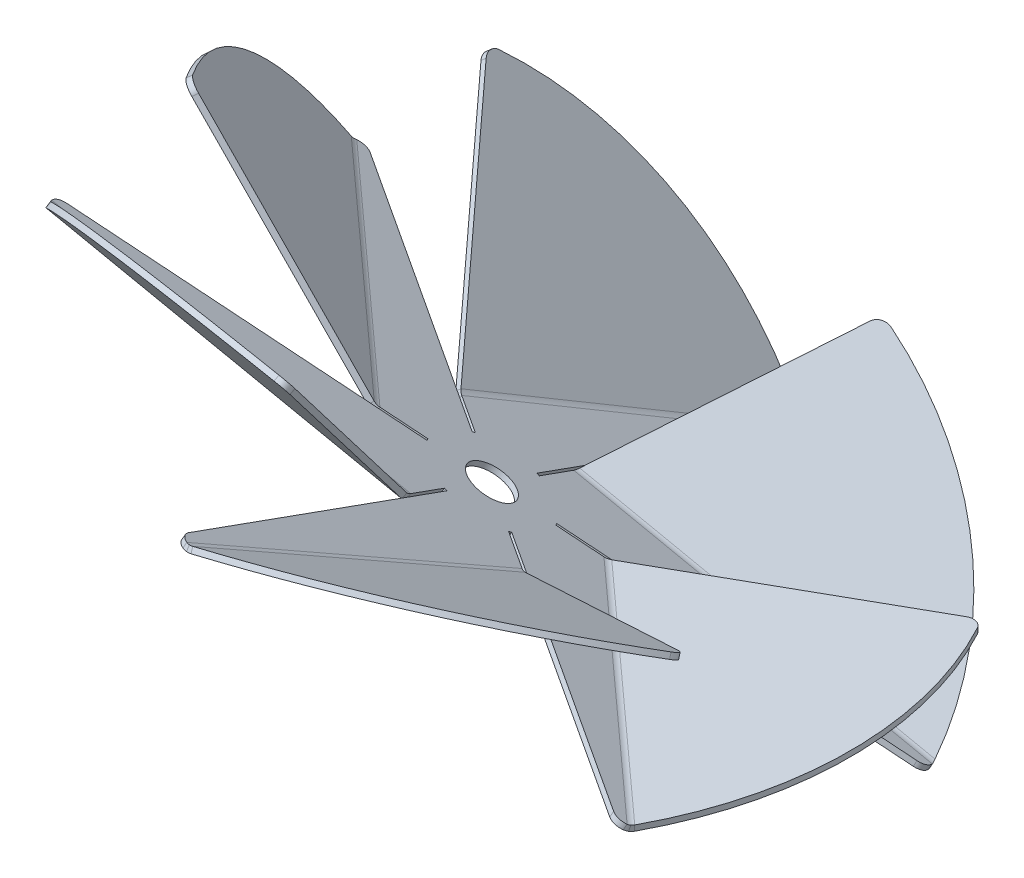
SolidWorks part; units mm, degrees
ref_plane "Front" through (0, 0, 0) normal (0, 0, 1) x (1, 0, 0)
ref_plane "Top" through (0, 0, 0) normal (0, 1, 0) x (1, 0, 0)
ref_plane "Right" through (0, 0, 0) normal (1, 0, 0) x (0, 0, -1)
sketch "Sketch1" plane through (0, 0, 0) normal (0, 1, 0) x (1, 0, 0)
  line L2 (-0.7937, -209.4282) -> (-0.7937, -31.7401)
  line L6 (0.7937, -209.4282) -> (0.7937, -31.7401)
  line L18 (27.0908, -16.5574) -> (180.9733, -105.4015)
  line L19 (27.8846, -15.1826) -> (181.767, -104.0267)
  line L20 (27.8846, 15.1826) -> (181.767, 104.0267)
  line L21 (27.0908, 16.5574) -> (180.9733, 105.4015)
  line L22 (0.7937, 31.7401) -> (0.7937, 209.4282)
  line L23 (-0.7937, 31.7401) -> (-0.7937, 209.4282)
  line L24 (-27.8846, 15.1826) -> (-181.767, 104.0267)
  line L25 (-27.0908, 16.5574) -> (-180.9733, 105.4015)
  line L26 (-27.8846, -15.1826) -> (-181.767, -104.0267)
  line L27 (-27.0908, -16.5574) -> (-180.9733, -105.4015)
  arc A0 (183.1861, 114.2614) -> (7.3602, 215.7745) centre (0, 0) ccw
  circle A1 centre (0, 0) radius 12.7
  arc A2 (-27.8846, -15.1826) -> (-27.0908, -16.5574) centre (0, 0) ccw
  arc A3 (-0.7937, -31.7401) -> (0.7937, -31.7401) centre (0, 0) ccw
  arc A4 (27.0908, -16.5574) -> (27.8846, -15.1826) centre (0, 0) ccw
  arc A5 (27.8846, 15.1826) -> (27.0908, 16.5574) centre (0, 0) ccw
  arc A6 (0.7937, 31.7401) -> (-0.7937, 31.7401) centre (0, 0) ccw
  arc A7 (-7.3602, 215.7745) -> (-183.1861, 114.2614) centre (0, 0) ccw
  arc A8 (-190.5463, 101.5131) -> (-190.5463, -101.5131) centre (0, 0) ccw
  arc A9 (-183.1861, -114.2614) -> (-7.3602, -215.7745) centre (0, 0) ccw
  arc A10 (7.3602, -215.7745) -> (183.1861, -114.2614) centre (0, 0) ccw
  arc A11 (180.9733, -105.4015) -> (183.1861, -114.2614) centre (177.7983, -110.9008) cw
  arc A12 (181.767, -104.0267) -> (190.5463, -101.5131) centre (184.942, -98.5274) ccw
  arc A13 (-27.0908, 16.5574) -> (-27.8846, 15.1826) centre (0, 0) ccw
  arc A14 (0.7937, -209.4282) -> (7.3602, -215.7745) centre (7.1437, -209.4282) ccw
  arc A15 (-0.7937, -209.4282) -> (-7.3602, -215.7745) centre (-7.1437, -209.4282) cw
  arc A16 (-180.9733, -105.4015) -> (-183.1861, -114.2614) centre (-177.7983, -110.9008) ccw
  arc A17 (-181.767, -104.0267) -> (-190.5463, -101.5131) centre (-184.942, -98.5274) cw
  arc A18 (-181.767, 104.0267) -> (-190.5463, 101.5131) centre (-184.942, 98.5274) ccw
  arc A19 (-180.9733, 105.4015) -> (-183.1861, 114.2614) centre (-177.7983, 110.9008) cw
  arc A20 (0.7937, 209.4282) -> (7.3602, 215.7745) centre (7.1437, 209.4282) cw
  arc A21 (-0.7937, 209.4282) -> (-7.3602, 215.7745) centre (-7.1437, 209.4282) ccw
  arc A22 (180.9733, 105.4015) -> (183.1861, 114.2614) centre (177.7983, 110.9008) ccw
  arc A23 (181.767, 104.0267) -> (190.5463, 101.5131) centre (184.942, 98.5274) cw
  arc A25 (190.5463, -101.5131) -> (190.5463, 101.5131) centre (0, 0) ccw
  point P30 (-0.7937, 253.9988)
  point P33 (0.7937, 253.9988)
  point P35 (0.7937, -215.8985)
  point P36 (219.5725, 127.6868)
  point P39 (220.3663, 126.312)
  point P41 (-0.7937, -215.8985)
  point P42 (219.5725, -127.6868)
  point P45 (220.3663, -126.312)
  point P46 (-186.5767, -108.6367)
  point P48 (0.7937, -253.9988)
  point P50 (-187.3705, -107.2619)
  point P51 (-0.7937, -253.9988)
  point P54 (-187.3705, 107.2619)
  point P56 (-219.5725, -127.6868)
  point P58 (-186.5767, 108.6367)
  point P61 (0.7937, 215.8985)
  point P64 (-0.7937, 215.8985)
  point P67 (186.5767, 108.6367)
  dimension "D1" = 431.8
  dimension "D2" = 6.35
sheet metal parameters "Sheet-Metal4" thickness 3.175 parameters "D1"=3.175
base flange "Base-Flange1" sketch "Sketch1" thickness 3.175 reverse thickness direction yes parameters "D1"=3.175
sketch "Sketch23" plane through (0, 3.175, 0) normal (0, 1, 0) x (1, 0, 0)
  line L3 (183.1861, 114.2614) -> (0.7937, 57.1445)
  line L5 (0.7937, 209.4282) -> (0.7937, 31.7401) construction
sketched bend "Sketched Bend10" parameters "D1"=6.35
bend "SketchBend26" bend radius 6.35 bend angle 30 parameters "D5"=7
sketch "Sketch24" plane through (0, 3.175, 0) normal (0, 1, 0) x (1, 0, 0)
  line L1 (190.5463, -101.5131) -> (49.8855, 27.8848)
  line L2 (181.767, 104.0267) -> (27.8846, 15.1826) construction
sketched bend "Sketched Bend11" parameters "D1"=6.35
bend "SketchBend27" bend radius 6.35 bend angle 30 parameters "D5"=8
sketch "Sketch25" plane through (10.1122, 25.8702, -10.9924) normal (0.3385, 0.866, -0.368) x (0.9409, -0.3092, 0.138)
  line L1 (183.0139, -98.1923) -> (22.7474, -21.4608) construction
  line L2 (18.4149, -221.6057) -> (45.661, -32.4313)
sketched bend "Sketched Bend13" parameters "D1"=6.35
bend "SketchBend28" bend radius 6.35 bend angle 30 parameters "D5"=9
sketch "Sketch28" plane through (38.4929, 31.7212, -9.3822) normal (0.7584, 0.625, -0.1849) x (-0.1445, -0.1153, -0.9828)
  line L1 (-200.0961, 73.3965) -> (-26.6765, 34.6834) construction
  line L2 (-67.4774, 230.6732) -> (-51.1132, 40.1385)
  line L3 (-200.0961, 73.3965) -> (-26.6765, 34.6834) construction
sketched bend "Sketched Bend14" parameters "D1"=6.35
bend "SketchBend29" bend radius 6.35 bend angle 30 parameters "D5"=10
sketch "Sketch29" plane through (38.4929, 31.7212, -9.3822) normal (0.7584, 0.625, -0.1849) x (-0.1445, -0.1153, -0.9828)
  line L1 (144.7172, 190.8456) -> (-12.2182, 81.7559)
  line L2 (-57.7978, 227.0584) -> (-4.6145, 57.5161) construction
sketched bend "Sketched Bend15" parameters "D1"=6.35
bend "SketchBend30" bend radius 6.35 bend angle 30 parameters "D5"=11
sketch "Sketch33" plane through (38.4929, 31.7212, -9.3822) normal (0.7584, 0.625, -0.1849) x (0.6515, -0.7195, 0.2406)
  line L1 (-211.2858, 97.1359) -> (-54.7594, 13.0375) construction
  line L4 (-211.2858, 97.1359) -> (-54.7594, 13.0375) construction
  line L5 (-37.2345, 201.1184) -> (-77.1383, 25.0612)
  arc A0 (-34.3705, 206.622) -> (-41.128, 212.7646) centre (-40.7176, 206.4279) ccw construction
sketched bend "Sketched Bend18" parameters "D1"=6.35
bend "SketchBend31" bend radius 6.35 bend angle 30 parameters "D5"=12
sketch "Sketch37" plane through (28.7528, 72.3942, -32.2674) normal (0.341, 0.8586, -0.3827) x (0.94, -0.3167, 0.127)
  line L0 (8.6191, -10.3873) -> (183.3365, -10.3873) construction
ref_plane "Plane4" through (0.1265, 4.1865, 9.5054) normal (0.0122, 0.403, 0.9151) x (0.9999, -0.0047, -0.0112)
sketch "Sketch38" plane through (0.1265, 4.1865, 9.5054) normal (0.0122, 0.403, 0.9151) x (0.9999, -0.0047, -0.0112)
  line L0 (62.5397, 146.6345) -> (33.0037, 74.3388) construction
sketch "Sketch39" plane through (0.1265, 4.1865, 9.5054) normal (0.0122, 0.403, 0.9151) x (0.9999, -0.0047, -0.0112)
  line L0 (66.3967, 140.3229) -> (44.287, 70.2427) construction
  line L1 (38.5742, 72.3166) -> (49.9998, 68.1689) construction
  ellipse E0 centre (61.1168, 143.8304) end of major axis (66.5135, 140.4841) minor radius 2.9579 (62.2082, 146.6213) -> (55.5725, 146.8525) ccw construction
flat pattern "Flat-Pattern4"
sketch "Bend-Lines4" plane through (0, 0, 0) normal (0, 1, 0) x (-1, 0, 0)
bend of the flat pattern "Flatten-<SketchBend26>1"
bend of the flat pattern "Flatten-<SketchBend27>1"
bend of the flat pattern "Flatten-<SketchBend28>1"
bend of the flat pattern "Flatten-<SketchBend29>1"
bend of the flat pattern "Flatten-<SketchBend30>1"
bend of the flat pattern "Flatten-<SketchBend31>1"
